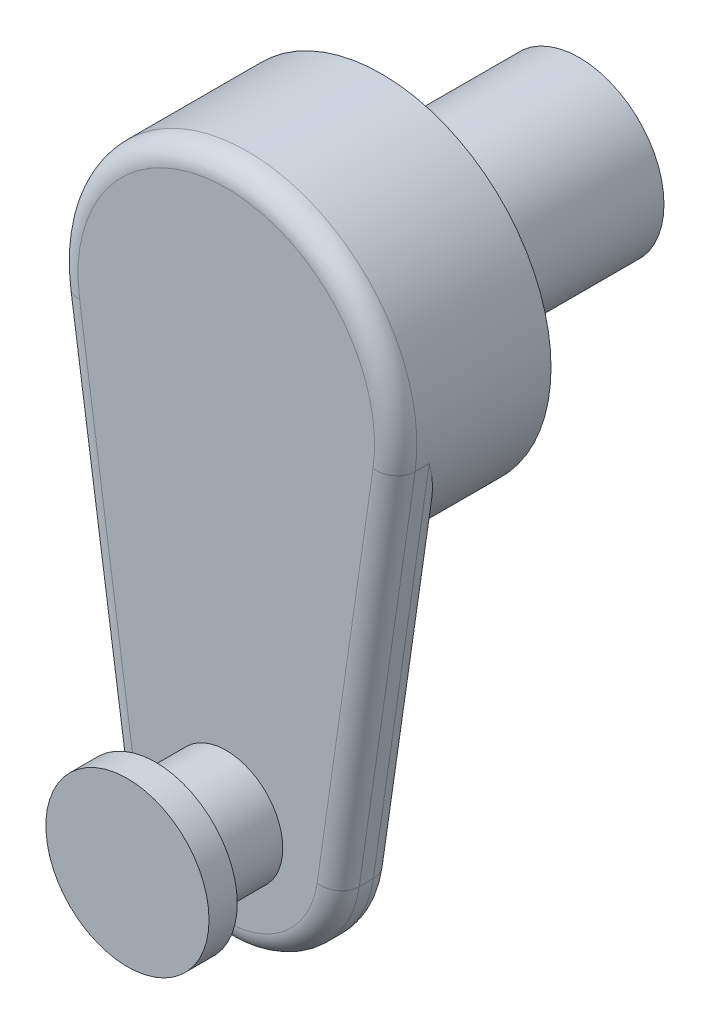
SolidWorks part; units mm, degrees
ref_plane "Plan de face" through (0, 0, 0) normal (0, 0, 1) x (1, 0, 0)
ref_plane "Plan de dessus" through (0, 0, 0) normal (0, 1, 0) x (1, 0, 0)
ref_plane "Plan de droite" through (0, 0, 0) normal (1, 0, 0) x (0, 0, -1)
sketch "Esquisse1" plane through (0, 0, 0) normal (0, 0, 1) x (1, 0, 0)
  circle A0 centre (0, 0) radius 6
extrude "Boss.-Extru.1" add sketch "Esquisse1" along normal blind 5.5
sketch "Esquisse2" plane through (0, 0, 0) normal (0, 0, -1) x (-1, 0, 0)
  circle A0 centre (0, 0) radius 3
extrude "Boss.-Extru.2" add sketch "Esquisse2" along normal blind 7
sketch "Esquisse3" plane through (0, 0, 5.5) normal (0, 0, 1) x (1, 0, 0)
  line L0 (0, 9.7479) -> (0, -28.324) construction
  line L1 (-3.959, -14.5714) -> (-5.9385, -0.8571)
  line L2 (3.959, -14.5714) -> (5.9385, -0.8571)
  arc A0 (5.9385, -0.8571) -> (-5.9385, -0.8571) centre (0, 0) ccw
  arc A1 (-3.959, -14.5714) -> (3.959, -14.5714) centre (0, -14) ccw
  dimension "D1" = 14
extrude "Boss.-Extru.3" add sketch "Esquisse3" against normal blind 2
fillet "Congé1" radius 0.75 4 edges at (0, 6, 5.5) (4.9487, -7.7143, 5.5) (0, -18, 5.5) (-4.9487, -7.7143, 5.5)
fillet "Congé2" radius 0.75 3 edges at (-4.9487, -7.7143, 3.5) (4.9487, -7.7143, 3.5) (0, -18, 3.5)
sketch "Esquisse4" plane through (0, 0, 5.5) normal (0, 0, 1) x (1, 0, 0)
  circle A0 centre (0, -14) radius 2
  dimension "D1" = 4
extrude "Boss.-Extru.4" add sketch "Esquisse4" along normal blind 2.5
sketch "Esquisse5" plane through (0, 0, 8) normal (0, 0, 1) x (1, 0, 0)
  circle A0 centre (0, -14) radius 2.8888
extrude "Boss.-Extru.5" add sketch "Esquisse5" along normal blind 1
